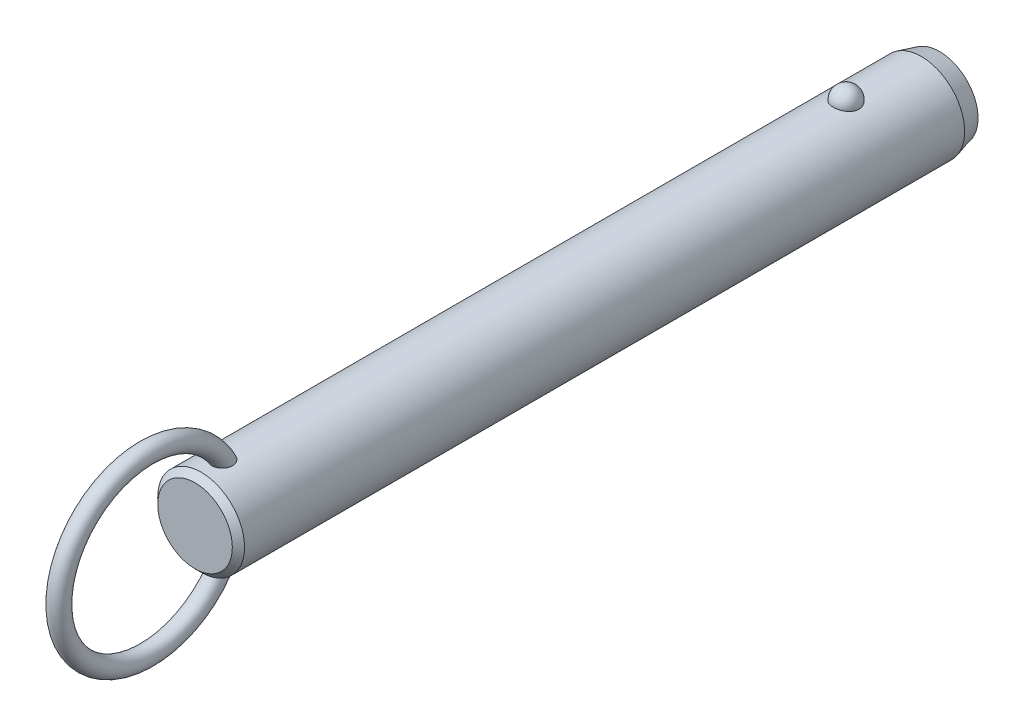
SolidWorks part; units mm, degrees
ref_plane "Front Plane" through (0, 0, 0) normal (0, 0, 1) x (1, 0, 0)
ref_plane "Top Plane" through (0, 0, 0) normal (0, 1, 0) x (1, 0, 0)
ref_plane "Right Plane" through (0, 0, 0) normal (1, 0, 0) x (0, 0, -1)
sketch "Sketch2" plane through (0, 0, 0) normal (0, 0, 1) x (1, 0, 0)
  circle A0 centre (0, 0) radius 7.1
  point P3 (0, 7.1)
  dimension "D1" = 14.2
extrude "Boss-Extrude1" add sketch "Sketch2" along normal blind 96.5
sketch "Sketch3" plane through (0, 0, 0) normal (0, 0, -1) x (-1, 0, 0)
  circle A0 centre (0, 0) radius 7.1
  dimension "D1" = 14.2
extrude "Boss-Extrude2" add sketch "Sketch3" along normal blind 17.4
chamfer "Chamfer1" distance 3 angle 15 1 edges at (-7.1, 0, -17.4)
sketch "Sketch12" plane through (0, 0, 0) normal (1, 0, 0) x (0, 0, -1)
  line L0 (-96.5, 7.1) -> (-96.5, -7.1) construction
  point P0 (-96.5, 0)
sketch "Sketch13" plane through (0, 0, 0) normal (1, 0, 0) x (0, 0, -1)
  circle A0 centre (-112.35, 0) radius 15.85
  point P2 (-96.5, 0)
  dimension "D1" = 31.7
sketch "Sketch14" plane through (0, 0, 0) normal (0, 1, 0) x (1, 0, 0)
  circle A0 centre (0, -98) radius 1.5
  point P2 (0, -96.5)
  dimension "D1" = 3
sweep "Sweep1" add profiles "Sketch14" path "Sketch13"
sketch "Sketch15" plane through (0, 0, 96.5) normal (0, 0, 1) x (1, 0, 0)
  circle A0 centre (0, 0) radius 7.1
  dimension "D1" = 14.2
extrude "Boss-Extrude3" add sketch "Sketch15" along normal blind 7.92
chamfer "Chamfer2" distance 1 angle 45 1 edges at (7.1, 0, 104.42)
sketch "Sketch18" plane through (0, 0, 0) normal (1, 0, 0) x (0, 0, -1)
  line L0 (14.4, 7.1) -> (-98.1792, 7.1) construction
  line L1 (2.1, 9.2) -> (2.1, 5)
  line L2 (-98.1792, -7.1) -> (14.4, -7.1) construction
  arc A0 (2.1, 9.2) -> (2.1, 5) centre (2.1, 7.1) ccw
  point P4 (0, 7.1)
  dimension "D1" = 16.3
revolve "Revolve1" add sketch "Sketch18" angle 360 about L1
